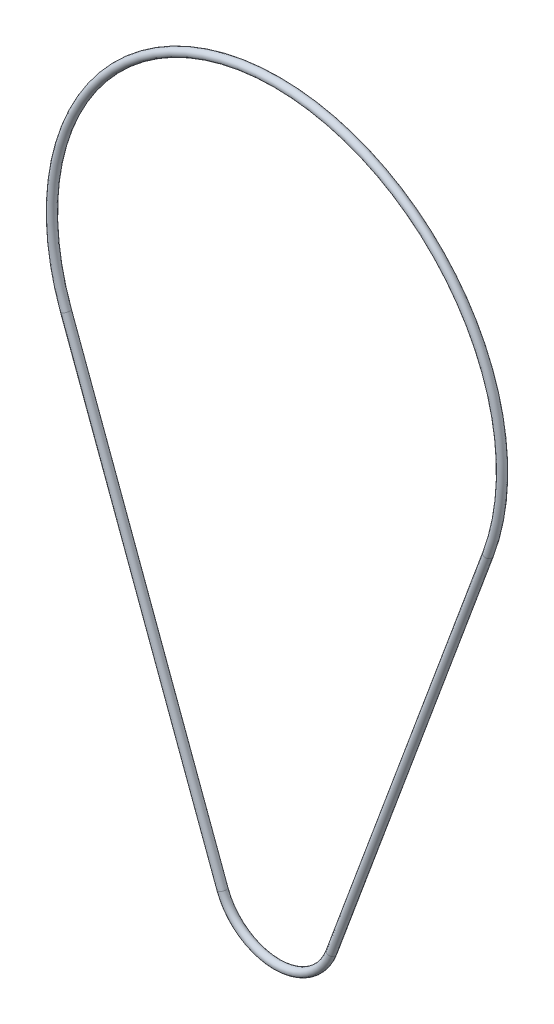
SolidWorks part; units mm, degrees
ref_plane "정면" through (0, 0, 0) normal (0, 0, 1) x (1, 0, 0)
ref_plane "윗면" through (0, 0, 0) normal (0, 1, 0) x (1, 0, 0)
ref_plane "우측면" through (0, 0, 0) normal (1, 0, 0) x (0, 0, -1)
sketch "스케치1" plane through (0, 0, 0) normal (0, 0, 1) x (1, 0, 0)
  line L0 (-10.5357, -3.9018) -> (-2.7195, -25.0071)
  line L1 (10.5357, -3.9018) -> (2.7195, -25.0071)
  arc A0 (10.5357, -3.9018) -> (-10.5357, -3.9018) centre (0, 0) ccw
  arc A1 (-2.7195, -25.0071) -> (2.7195, -25.0071) centre (0, -24) ccw
  dimension "D1" = 22.47
  dimension "D2" = 5.8
  dimension "D3" = 24
sweep "스윕1" add path "스케치1" parameters "D3"=0.4
